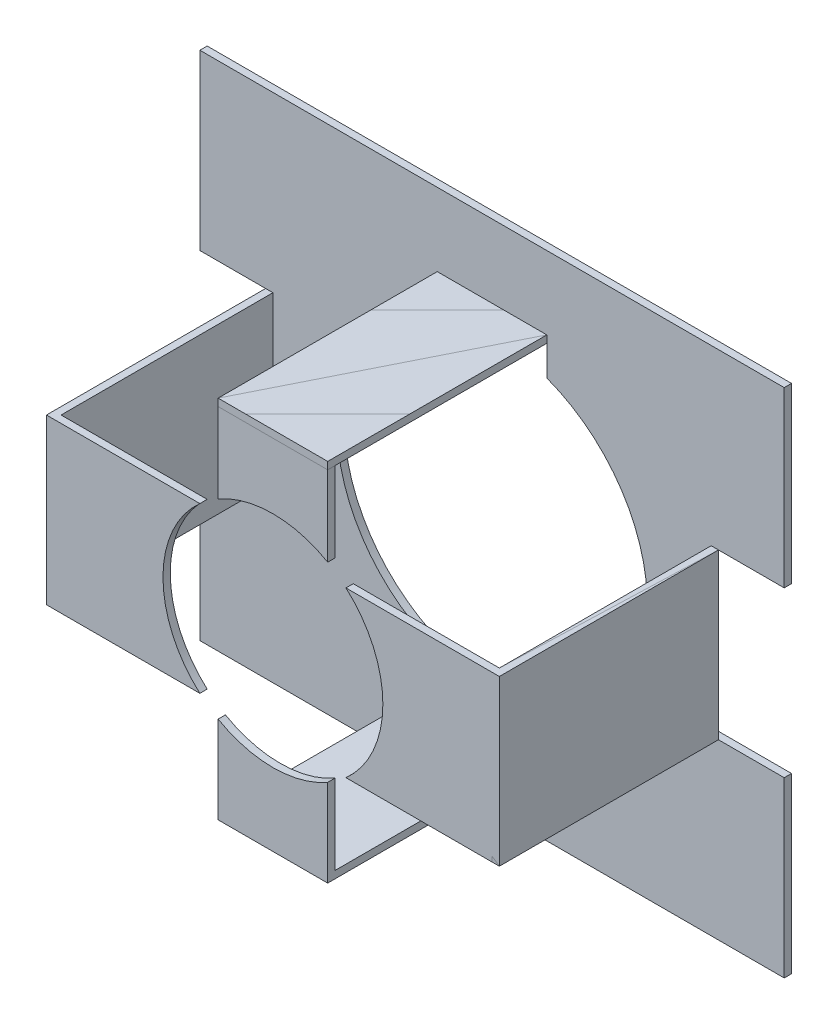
SolidWorks part; units mm, degrees
ref_plane "Face" through (0, 0, 0) normal (0, 0, 1) x (1, 0, 0)
ref_plane "Dessus" through (0, 0, 0) normal (0, 1, 0) x (1, 0, 0)
ref_plane "Droite" through (0, 0, 0) normal (1, 0, 0) x (0, 0, -1)
sketch "Esquisse1" plane through (0, 0, 0) normal (0, 0, 1) x (1, 0, 0)
  line L0 (0, 0) -> (0, 9.5134) construction
  line L1 (-8, 7) -> (8, 7)
  line L2 (-8, 7) -> (-8, 2.25)
  line L3 (-8, -7) -> (8, -7)
  line L4 (8, 7) -> (8, 2.25)
  line L5 (-9.5486, 0) -> (10.318, 0) construction
  line L6 (-8, 2.25) -> (-6, 2.25)
  line L7 (-6, 2.25) -> (-6, -2.25)
  line L8 (-8, -2.25) -> (-6, -2.25)
  line L9 (8, -2.25) -> (6, -2.25)
  line L10 (-8, -2.25) -> (-8, -7)
  line L11 (6, 2.25) -> (6, -2.25)
  line L12 (8, 2.25) -> (6, 2.25)
  line L13 (-1.5, 3.9765) -> (-1.5, 5)
  line L14 (8, -2.25) -> (8, -7)
  line L15 (-1.5, 5) -> (1.5, 5)
  line L16 (1.5, 5) -> (1.5, 3.9765)
  line L17 (1.5, -5) -> (1.5, -3.9765)
  line L18 (-1.5, -5) -> (1.5, -5)
  line L19 (-1.5, -3.9765) -> (-1.5, -5)
  arc A0 (1.5, -3.9765) -> (1.5, 3.9765) centre (0, 0) ccw
  arc A1 (-1.5, 3.9765) -> (-1.5, -3.9765) centre (0, 0) ccw
  point P14 (-6, 0)
  point P15 (0, 0)
  point P27 (-0.6236, -4.204)
  dimension "D11" = 4.25
  dimension "D2" = 16
  dimension "D3" = 3
  dimension "D4" = 14
  dimension "D5" = 7
  dimension "D6" = 2.25
  dimension "D7" = 2
  dimension "D8" = 7
  dimension "D9" = 1.5
  dimension "D10" = 5
extrude "Extrusion1" add sketch "Esquisse1" along normal blind 0.2
sketch "Esquisse2" plane through (0, 0, 0.2) normal (0, 0, 1) x (1, 0, 0)
  line L0 (-6, -2.25) -> (-8, -2.25) construction
  line L1 (-6, 2.25) -> (-6.2, 2.25)
  line L2 (-6, 2.25) -> (-6, -2.25)
  line L3 (-6, -2.25) -> (-6.2, -2.25)
  line L4 (-6.2, 2.25) -> (-6.2, -2.25)
  line L5 (0, 7.5319) -> (0, -7.3308) construction
  line L6 (1.5, 3.9765) -> (1.5, 5) construction
  line L7 (-1.5, 5) -> (1.5, 5)
  line L8 (-1.5, 5) -> (-1.5, 4.8)
  line L9 (-1.5, 4.8) -> (1.5, 4.8)
  line L10 (1.5, 5) -> (1.5, 4.8)
  line L11 (6.2, 2.25) -> (6.2, -2.25)
  line L12 (6, -2.25) -> (6.2, -2.25)
  line L13 (6, 2.25) -> (6, -2.25)
  line L14 (6, 2.25) -> (6.2, 2.25)
  line L15 (-7.047, 0) -> (7.5452, 0) construction
  line L16 (1.5, -5) -> (1.5, -4.8)
  line L17 (-1.5, -4.8) -> (1.5, -4.8)
  line L18 (-1.5, -5) -> (-1.5, -4.8)
  line L19 (-1.5, -5) -> (1.5, -5)
  dimension "D1" = 0.2
  dimension "D2" = 0.2
extrude "Extrusion2" add sketch "Esquisse2" along normal blind 6
sketch "Esquisse3" plane through (-6, 0, 0) normal (1, 0, 0) x (0, 0, -1)
  line L0 (-6.2, -2.25) -> (-0.2, -2.25) construction
  line L1 (-6.2, 2.25) -> (-6, 2.25)
  line L2 (-6.2, 2.25) -> (-6.2, -2.25)
  line L3 (-6.2, -2.25) -> (-6, -2.25)
  line L4 (-6, 2.25) -> (-6, -2.25)
  dimension "D1" = 0.2
extrude "Extrusion5" add sketch "Esquisse3" along normal blind 4
mirror "Symétrie4" about plane through (0, 0, 0) normal (1, 0, 0)
sketch "Esquisse4" plane through (0, -4.8, 0) normal (0, 1, 0) x (-1, 0, 0)
  line L0 (1.5, 6.2) -> (1.5, 0.2) construction
  line L1 (-1.5, 6.2) -> (1.5, 6.2)
  line L2 (-1.5, 6.2) -> (-1.5, 6)
  line L3 (-1.5, 6) -> (1.5, 6)
  line L4 (1.5, 6.2) -> (1.5, 6)
  dimension "D1" = 0.2
extrude "Extrusion6" add sketch "Esquisse4" along normal blind 4
mirror "Symétrie6" about plane through (0, 0, 0) normal (0, 1, 0)
sketch "Esquisse5" plane through (0, 0, 6.2) normal (0, 0, 1) x (1, 0, 0)
  circle A0 centre (0, 0) radius 3.0104
extrude "Enlèv. mat.-Extru.1" cut sketch "Esquisse5" against normal blind 4
